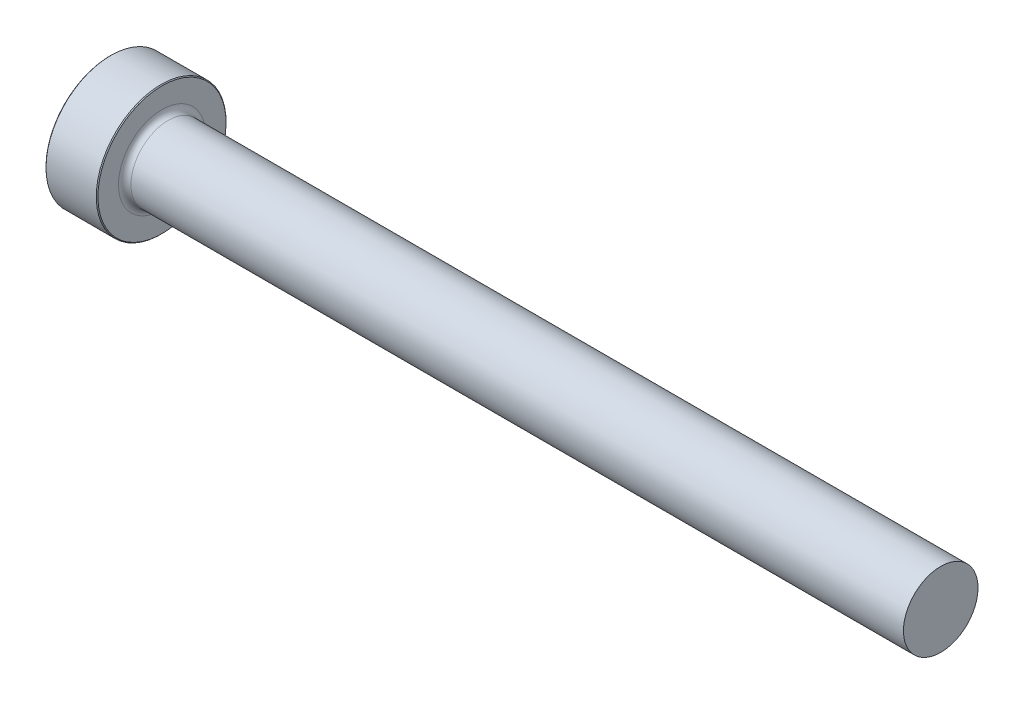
SolidWorks part; units mm, degrees
ref_plane "Front Plane" through (0, 0, 0) normal (0, 0, 1) x (1, 0, 0)
ref_plane "Top Plane" through (0, 0, 0) normal (0, 1, 0) x (1, 0, 0)
ref_plane "Right Plane" through (0, 0, 0) normal (1, 0, 0) x (0, 0, -1)
sketch "Sketch1" plane through (0, 0, 0) normal (0, 0, 1) x (1, 0, 0)
  line L0 (0, 0) -> (0, 7.9375)
  line L1 (0, 7.9375) -> (6.35, 7.9375)
  line L2 (6.35, 7.9375) -> (6.35, 5.3223)
  line L3 (7.112, 4.5603) -> (101.6, 4.5603)
  line L4 (101.6, 4.5603) -> (101.6, 0)
  line L5 (101.6, 0) -> (0, 0)
  line L6 (101.6, 0) -> (101.6, -4.5603) construction
  line L7 (101.6, -4.5603) -> (6.35, -4.5603) construction
  line L8 (0, 0) -> (0, -7.9375) construction
  line L9 (0, -7.9375) -> (6.35, -7.9375) construction
  line L10 (6.35, -7.9375) -> (6.35, -4.5603) construction
  arc A0 (6.35, 5.3223) -> (7.112, 4.5603) centre (7.112, 5.3223) ccw
  dimension "D4" = 0.762
  dimension "L" = 101.6
  dimension "D" = 9.1205
  dimension "H" = 15.875
  dimension "T" = 6.35
revolve "Revolve1" add sketch "Sketch1" angle 360 about L5
chamfer "Chamfer1" distance 0.1016 angle 45 2 edges at (0, 7.9375, 0) (6.35, 7.9375, 0)
